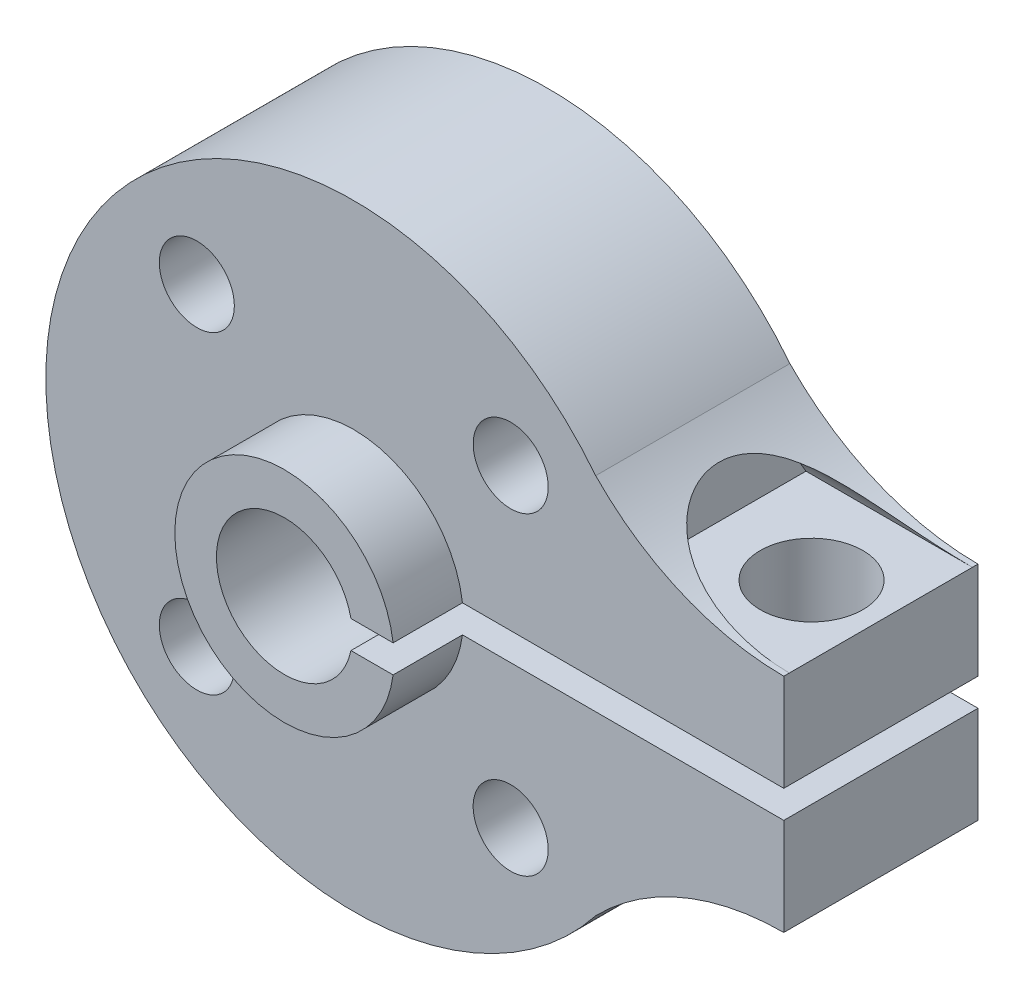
SolidWorks part; units mm, degrees
ref_plane "Front Plane" through (0, 0, 0) normal (0, 0, 1) x (1, 0, 0)
ref_plane "Top Plane" through (0, 0, 0) normal (0, 1, 0) x (1, 0, 0)
ref_plane "Right Plane" through (0, 0, 0) normal (1, 0, 0) x (0, 0, -1)
sketch "Sketch1" plane through (0, 0, 0) normal (0, 0, 1) x (1, 0, 0)
  line L0 (-18.136, 0) -> (24.0528, 0) construction
  line L1 (0, 0) -> (0, 0.5)
  line L2 (0, 0.5) -> (15.5, 0.5)
  line L3 (15.5, 0.5) -> (15.5, 4)
  line L5 (0, 0) -> (0, -0.5)
  line L6 (0, -0.5) -> (15.5, -0.5)
  line L7 (15.5, -0.5) -> (15.5, -4)
  arc A0 (8.7199, 6.8683) -> (8.7199, -6.8683) centre (0, 0) ccw
  arc A6 (15.5, 4) -> (8.7199, 6.8683) centre (15.5, 13.4476) cw
  arc A7 (15.5, -4) -> (8.7199, -6.8683) centre (15.5, -13.4476) ccw
  dimension "D1" = 22.2
  dimension "D3" = 0.5
  dimension "D4" = 0.5
  dimension "D5" = 3.5
  dimension "D6" = 3.5
  dimension "D7" = 15.5
  dimension "D8" = 15.5
extrude "Extrude1" add sketch "Sketch1" against normal blind 7
sketch "Sketch2" plane through (0, 0, 0) normal (0, 0, 1) x (1, 0, 0)
  circle A1 centre (5.6572, 5.6565) radius 1.85
  circle A2 centre (-5.6572, -5.6565) radius 1.85
  circle A3 centre (5.6565, -5.6572) radius 1.85
  circle A4 centre (-5.6565, 5.6572) radius 1.85
hole_wizard "#6-32 Tapped Hole3" positions "3DSketch3" profile "Sketch5" tap size "#6-32" standard "Ansi Inch"
sketch3d "3DSketch3"
  point P0 (-5.6565, 5.6572, 0)
  point P3 (5.6572, 5.6565, 0)
  point P6 (5.6565, -5.6572, 0)
  point P9 (-5.6572, -5.6565, 0)
sketch "Sketch5" plane through (-5.6565, 5.6572, 0) normal (1, 0, 0) x (0, -1, 0)
  line L0 (0, 0) -> (0, 7)
  line L1 (0, 7) -> (1.3525, 7)
  line L2 (1.3525, 7) -> (1.3525, 0)
  line L5 (1.3525, 0) -> (0, 0)
  line L11 (0, -6.35) -> (0, 107.95) construction
  dimension "Thru Tap Drill Dia." = 2.7051
  dimension "Thru Tap Drill Depth" = 7
sketch "Sketch8" plane through (0, 0, 0) normal (0, 0, 1) x (1, 0, 0)
  line L0 (3.9182, -0.5) -> (0, -0.5)
  line L1 (15.5, -0.5) -> (0, -0.5) construction
  line L2 (0, -0.5) -> (0, 0.5)
  line L3 (0, 0.5) -> (3.9182, 0.5)
  line L4 (0, 0.5) -> (15.5, 0.5) construction
  arc A0 (3.9182, 0.5) -> (3.9182, -0.5) centre (0, 0) ccw
  dimension "D1" = 7.9
extrude "Extrude3" add sketch "Sketch8" along normal blind 2.5
sketch "Sketch9" plane through (0, 0, 2.5) normal (0, 0, 1) x (1, 0, 0)
  circle A0 centre (0, 0) radius 2.45
  dimension "D1" = 4.9
extrude "Cut-Extrude3" cut sketch "Sketch9" against normal through all
sketch "Sketch14" plane through (0, 0.5, 0) normal (0, -1, 0) x (1, 0, 0)
  line L0 (15.5, -7) -> (15.5, 0) construction
  circle A0 centre (13, -3.5) radius 1.85
  dimension "D1" = 3.7
  dimension "D2" = 2.5
extrude "Cut-Extrude6" cut sketch "Sketch14" against normal through all
hole_wizard "#6-32 Tapped Hole5" positions "Sketch19" profile "Sketch18" tap size "#6-32" standard "Ansi Inch"
sketch "Sketch19" plane through (0, -0.5, 0) normal (0, 1, 0) x (-1, 0, 0)
  line L0 (-15.5, -7) -> (-15.5, 0) construction
  point P0 (-13, -3.5)
  dimension "D1" = 2.5
sketch "Sketch18" plane through (13, -0.5, -3.5) normal (1, 0, 0) x (0, 0, 1)
  line L0 (0, 0) -> (0, 51.6127)
  line L1 (0, 51.6127) -> (1.3525, 50.8)
  line L2 (1.3525, 50.8) -> (1.3525, 0)
  line L5 (1.3525, 0) -> (0, 0)
  line L10 (0, 51.6127) -> (-1.3526, 50.8) construction
  line L11 (0, -6.35) -> (0, 107.95) construction
  dimension "Tap Drill Dia." = 2.7051
  dimension "Tap Drill Depth" = 50.8
  dimension "Drill Angle" = 118
sketch "Sketch24" plane through (15.5, 0, 0) normal (1, 0, 0) x (0, 0, -1)
  line L1 (7, 4) -> (0, 4) construction
  line L2 (0.2, 4) -> (6.8, 4)
  arc A0 (0.2, 4) -> (6.8, 4) centre (3.5, 2.3082) cw
  dimension "D1" = 0.2
  dimension "D2" = 0.2
extrude "Cut-Extrude26" cut sketch "Sketch24" against normal blind 6
